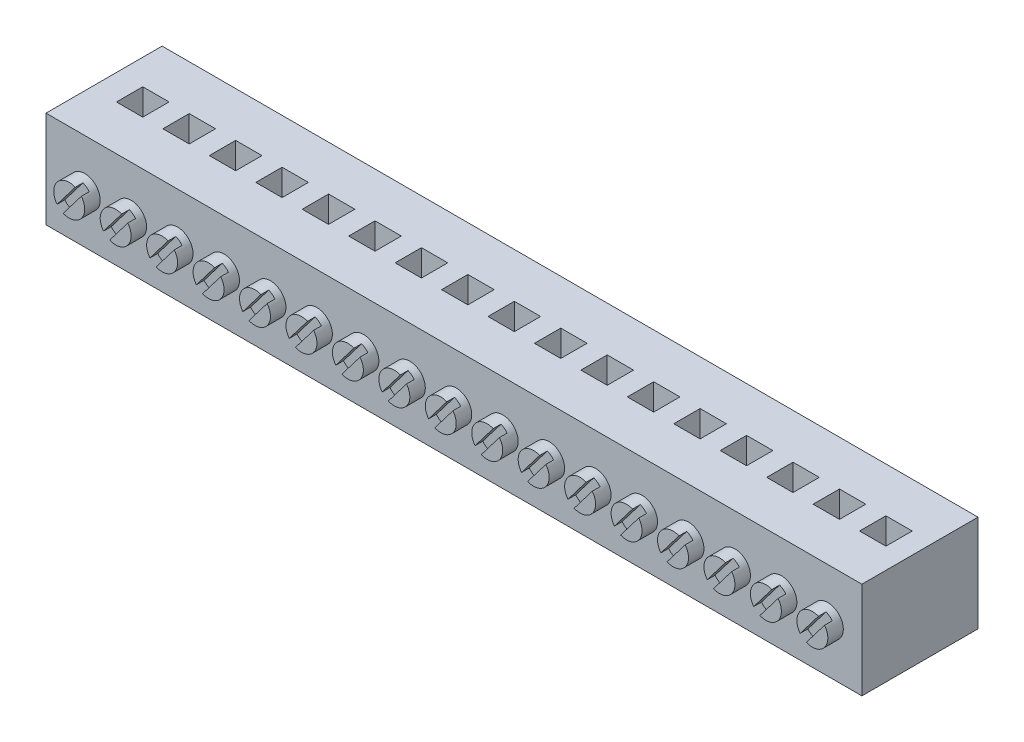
SolidWorks part; units mm, degrees
ref_plane "Front" through (0, 0, 0) normal (0, 0, 1) x (1, 0, 0)
ref_plane "Top" through (0, 0, 0) normal (0, 1, 0) x (1, 0, 0)
ref_plane "Right" through (0, 0, 0) normal (1, 0, 0) x (0, 0, -1)
sketch "Sketch1" plane through (0, 0, 0) normal (0, 0, 1) x (1, 0, 0)
  line L0 (66.929, -7.9375) -> (-66.929, 7.9375) construction
  line L1 (-66.929, 7.9375) -> (66.929, 7.9375)
  line L2 (-66.929, 7.9375) -> (-66.929, -7.9375)
  line L3 (-66.929, -7.9375) -> (66.929, -7.9375)
  line L4 (66.929, 7.9375) -> (66.929, -7.9375)
  dimension "D1" = 133.858
  dimension "D2" = 15.875
extrude "strip base" add sketch "Sketch1" along normal mid plane 19.05
sketch "Sketch2" plane through (0, 0, 9.525) normal (0, 0, 1) x (1, 0, 0)
  line L0 (-66.929, 0) -> (96.0532, 0) construction
  line L1 (-66.929, 7.9375) -> (-66.929, -7.9375) construction
  line L2 (-60.579, 0) -> (-60.579, 2.54) construction
  circle A0 centre (-60.579, 0) radius 2.54
  dimension "D2" = 5.08
  dimension "D1" = 6.35
extrude "screw body" add sketch "Sketch2" along normal blind 2.54
sketch "Sketch3" plane through (0, 0, 12.065) normal (0, 0, 1) x (1, 0, 0)
  line L0 (-59.0398, 2.0205) -> (-62.1182, -2.0205)
  circle A0 centre (-60.579, 0) radius 2.54 construction
  point P4 (-60.579, 0)
extrude "screw slot" cut sketch "Sketch3" against normal blind 1.27 and the other way blind 2.54 thin
ref_plane "slot end face" through (0, 2.54, 0) normal (0, 1, 0) x (-1, 0, 0)
sketch "Sketch4" plane through (0, -7.9375, 0) normal (0, -1, 0) x (1, 0, 0)
  line L0 (-58.42, -2.159) -> (-62.738, 2.159) construction
  line L1 (-62.738, 2.159) -> (-58.42, 2.159)
  line L2 (-62.738, 2.159) -> (-62.738, -2.159)
  line L3 (-62.738, -2.159) -> (-58.42, -2.159)
  line L4 (-58.42, 2.159) -> (-58.42, -2.159)
  line L5 (-66.929, 0) -> (88.5697, 0) construction
  line L6 (-66.929, 9.525) -> (-66.929, -9.525) construction
  line L7 (-60.579, 12.065) -> (-60.579, 10.795) construction
  point P4 (-60.579, 0)
  dimension "D1" = 4.318
extrude "wire hole" cut sketch "Sketch4" against normal through all
pattern_linear "LPattern1" count 17 spacing 7.62 along (1, 0, 0) of "screw body", "screw slot", "wire hole"
equation "\"D1@Sketch1\" = \"D1@LPattern1\" *.31"
